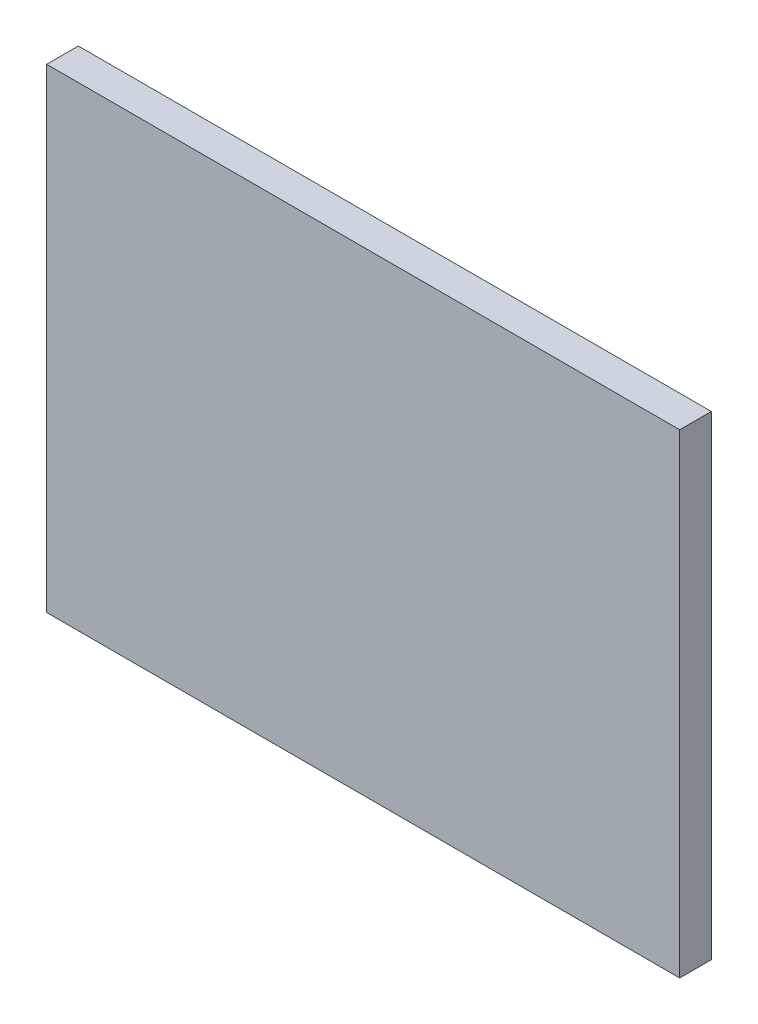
SolidWorks part; units mm, degrees
ref_plane "Ebene vorne" through (0, 0, 0) normal (0, 0, 1) x (1, 0, 0)
ref_plane "Ebene oben" through (0, 0, 0) normal (0, 1, 0) x (1, 0, 0)
ref_plane "Ebene rechts" through (0, 0, 0) normal (1, 0, 0) x (0, 0, -1)
sketch "Skizze1" plane through (0, 0, 0) normal (0, 0, 1) x (1, 0, 0)
  line L1 (0, 0) -> (100, 0)
  line L2 (0, 0) -> (0, -75)
  line L3 (0, -75) -> (100, -75)
  line L4 (100, 0) -> (100, -75)
  dimension "D1" = 100
  dimension "D2" = 75
extrude "Linear austragen1" add sketch "Skizze1" along normal blind 5
